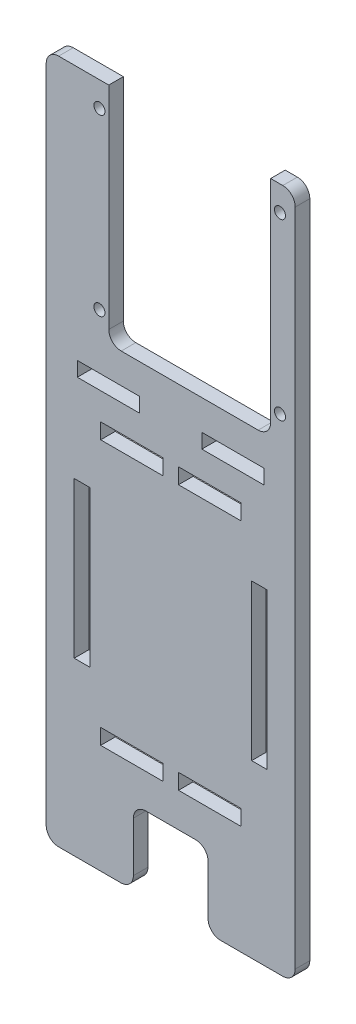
SolidWorks part; units mm, degrees
ref_plane "Front Plane" through (0, 0, 0) normal (0, 0, 1) x (1, 0, 0)
ref_plane "Top Plane" through (0, 0, 0) normal (0, 1, 0) x (1, 0, 0)
ref_plane "Right Plane" through (0, 0, 0) normal (1, 0, 0) x (0, 0, -1)
sketch "Sketch1" plane through (0, 0, 0) normal (0, 0, 1) x (1, 0, 0)
  line L1 (-25.4, -69.85) -> (25.4, -69.85)
  line L2 (-25.4, -69.85) -> (-25.4, 69.85)
  line L3 (-25.4, 69.85) -> (25.4, 69.85)
  line L4 (25.4, -69.85) -> (25.4, 69.85)
  line L5 (-25.4, -69.85) -> (25.4, 69.85) construction
  line L6 (-25.4, 69.85) -> (25.4, -69.85) construction
  point P0 (0, 0)
  dimension "D1" = 139.7
  dimension "D2" = 50.8
extrude "Boss-Extrude1" add sketch "Sketch1" along normal blind 2.9718
sketch "Sketch3" plane through (0, 0, 2.9718) normal (0, 0, 1) x (1, 0, 0)
  line L0 (0, -69.85) -> (0, 0.6319) construction
  line L1 (-25.4, -69.85) -> (25.4, -69.85) construction
  line L3 (-7.62, -54.61) -> (7.62, -54.61)
  line L4 (-7.62, -54.61) -> (-7.62, -92.71)
  line L5 (-7.62, -92.71) -> (7.62, -92.71)
  line L6 (7.62, -54.61) -> (7.62, -92.71)
  line L7 (-7.62, -54.61) -> (7.62, -92.71) construction
  line L8 (-7.62, -92.71) -> (7.62, -54.61) construction
  point P5 (0, -73.66)
  dimension "D1" = 38.1
  dimension "D2" = 15.24
  dimension "D3" = 22.86
extrude "Cut-Extrude2" cut sketch "Sketch3" against normal through all
sketch "Sketch22" plane through (0, 0, 2.9718) normal (0, 0, 1) x (1, 0, 0)
  line L0 (25.4, 69.85) -> (-25.4, 69.85) construction
  line L1 (-12.6375, 69.85) -> (20.3825, 69.85)
  line L2 (-12.6375, 69.85) -> (-12.6375, 24.13)
  line L3 (-12.6375, 24.13) -> (20.3825, 24.13)
  line L4 (20.3825, 69.85) -> (20.3825, 24.13)
  line L5 (-12.6375, 69.85) -> (20.3825, 24.13) construction
  line L6 (-12.6375, 24.13) -> (20.3825, 69.85) construction
  line L7 (0, 0) -> (0, 122.4243) construction
  point P0 (3.8725, 46.99)
  dimension "D1" = 33.02
  dimension "D2" = 45.72
  dimension "D3" = 22.86
  dimension "D4" = 3.8725
extrude "Cut-Extrude8" cut sketch "Sketch22" against normal through all
hole_wizard "#2 Clearance Hole1" positions "Sketch24" profile "Sketch25" hole size "#2" standard "ANSI Inch"
sketch "Sketch24" plane through (0, 0, 2.9718) normal (0, 0, 1) x (1, 0, 0)
  line L0 (22.2875, 69.85) -> (22.2875, 79.055) construction
  line L1 (25.4, 69.85) -> (20.3825, 69.85) construction
  line L3 (-14.5425, 69.85) -> (-14.5425, 79.5197) construction
  line L4 (-12.6375, 69.85) -> (-25.4, 69.85) construction
  line L6 (-25.4, 64.77) -> (25.4, 64.77) construction
  line L7 (-25.4, 69.85) -> (-25.4, -69.85) construction
  line L8 (25.4, -69.85) -> (25.4, 69.85) construction
  line L10 (-25.4, 29.21) -> (25.4, 29.21) construction
  line L12 (20.3825, 24.13) -> (20.3825, 69.85) construction
  line L14 (-12.6375, 69.85) -> (-12.6375, 24.13) construction
  line L15 (-12.6375, 24.13) -> (20.3825, 24.13) construction
  point P32 (-14.5425, 64.77)
  point P34 (-14.5425, 29.21)
  point P36 (22.2875, 64.77)
  point P38 (22.2875, 29.21)
  dimension "D1" = 5.08
  dimension "D2" = 1.905
  dimension "D3" = 1.905
  dimension "D4" = 5.08
sketch "Sketch25" plane through (22.2875, 29.21, 2.9718) normal (1, 0, 0) x (0, -1, 0)
  line L0 (0, 0) -> (0, 2.9718)
  line L1 (0, 2.9718) -> (1.1303, 2.9718)
  line L2 (1.1303, 2.9718) -> (1.1303, 0)
  line L5 (1.1303, 0) -> (0, 0)
  line L11 (0, -6.35) -> (0, 107.95) construction
  dimension "Thru Hole Dia." = 2.2606
  dimension "Thru Hole Depth" = 2.9718
fillet "Fillet1" radius 2.54 10 edges at (20.3825, 24.13, 1.4859) (-12.6375, 24.13, 1.4859) (-25.4, 69.85, 1.4859) (25.4, 69.85, 1.4859) (-25.4, -69.85, 1.4859) (25.4, -69.85, 1.4859) (-7.62, -54.61, 1.4859) (-7.62, -69.85, 1.4859) (7.62, -69.85, 1.4859) (7.62, -54.61, 1.4859)
sketch "Sketch26" plane through (0, 0, 2.9718) normal (0, 0, 1) x (1, 0, 0)
  line L0 (0, 0) -> (0, -75.1956) construction
  line L1 (0, 0) -> (23.1244, 0) construction
  line L2 (-20.2138, -19.05) -> (21.3275, -19.05) construction
  line L3 (7.9375, -18.5177) -> (7.9375, -58.8203) construction
  line L4 (16.51, -3.175) -> (19.685, -3.175)
  line L5 (16.51, -3.175) -> (16.51, -34.925)
  line L6 (16.51, -34.925) -> (19.685, -34.925)
  line L7 (19.685, -3.175) -> (19.685, -34.925)
  line L8 (16.51, -3.175) -> (19.685, -34.925) construction
  line L9 (16.51, -34.925) -> (19.685, -3.175) construction
  line L10 (-16.51, -34.925) -> (-19.685, -3.175) construction
  line L11 (1.5875, -44.45) -> (14.2875, -44.45)
  line L12 (1.5875, -44.45) -> (1.5875, -47.625)
  line L13 (1.5875, -47.625) -> (14.2875, -47.625)
  line L14 (14.2875, -44.45) -> (14.2875, -47.625)
  line L15 (1.5875, -44.45) -> (14.2875, -47.625) construction
  line L16 (1.5875, -47.625) -> (14.2875, -44.45) construction
  line L17 (-16.51, -3.175) -> (-19.685, -34.925) construction
  line L18 (-19.685, -3.175) -> (-19.685, -34.925)
  line L19 (-16.51, -34.925) -> (-19.685, -34.925)
  line L20 (-16.51, -3.175) -> (-16.51, -34.925)
  line L21 (-16.51, -3.175) -> (-19.685, -3.175)
  line L22 (-1.5875, -47.625) -> (-14.2875, -44.45) construction
  line L23 (-1.5875, -44.45) -> (-14.2875, -47.625) construction
  line L24 (-7.9375, -18.5177) -> (-7.9375, -58.8203) construction
  line L25 (-14.2875, -44.45) -> (-14.2875, -47.625)
  line L26 (-1.5875, -47.625) -> (-14.2875, -47.625)
  line L27 (-1.5875, -44.45) -> (-1.5875, -47.625)
  line L28 (-1.5875, -44.45) -> (-14.2875, -44.45)
  line L29 (-1.5875, 6.35) -> (-14.2875, 9.525) construction
  line L30 (-1.5875, 9.525) -> (-14.2875, 6.35) construction
  line L31 (1.5875, 9.525) -> (14.2875, 6.35) construction
  line L32 (1.5875, 6.35) -> (14.2875, 9.525) construction
  line L33 (-1.5875, 6.35) -> (-14.2875, 6.35)
  line L34 (-1.5875, 6.35) -> (-1.5875, 9.525)
  line L35 (-1.5875, 9.525) -> (-14.2875, 9.525)
  line L36 (-14.2875, 6.35) -> (-14.2875, 9.525)
  line L37 (14.2875, 6.35) -> (14.2875, 9.525)
  line L38 (1.5875, 9.525) -> (14.2875, 9.525)
  line L39 (1.5875, 6.35) -> (1.5875, 9.525)
  line L40 (1.5875, 6.35) -> (14.2875, 6.35)
  point P7 (18.0975, -19.05)
  point P13 (7.9375, -46.0375)
  point P22 (-18.0975, -19.05)
  point P29 (-7.9375, -46.0375)
  point P38 (-7.9375, 7.9375)
  point P39 (7.9375, 7.9375)
extrude "Cut-Extrude9" cut sketch "Sketch26" against normal through all
sketch "Sketch27" plane through (0, 0, 2.9718) normal (0, 0, 1) x (1, 0, 0)
  line L0 (0, 0) -> (0, 39.0224) construction
  line L1 (-31.7319, 16.51) -> (33.2642, 16.51) construction
  line L2 (-6.35, 15.0241) -> (-19.05, 17.9959) construction
  line L3 (6.35, 17.9959) -> (19.05, 17.9959)
  line L4 (6.35, 17.9959) -> (6.35, 15.0241)
  line L5 (6.35, 15.0241) -> (19.05, 15.0241)
  line L6 (19.05, 17.9959) -> (19.05, 15.0241)
  line L7 (6.35, 17.9959) -> (19.05, 15.0241) construction
  line L8 (6.35, 15.0241) -> (19.05, 17.9959) construction
  line L9 (-6.35, 17.9959) -> (-19.05, 15.0241) construction
  line L10 (31.7319, 16.51) -> (-33.2642, 16.51) construction
  line L11 (-19.05, 17.9959) -> (-19.05, 15.0241)
  line L12 (-6.35, 15.0241) -> (-19.05, 15.0241)
  line L13 (-6.35, 17.9959) -> (-6.35, 15.0241)
  line L14 (-6.35, 17.9959) -> (-19.05, 17.9959)
  line L15 (-10.0975, 24.13) -> (17.8425, 24.13) construction
  point P5 (12.7, 16.51)
  point P16 (-12.7, 16.51)
extrude "Cut-Extrude10" cut sketch "Sketch27" against normal through all
sketch "Sketch28" plane through (0, 0, 2.9718) normal (0, 0, 1) x (1, 0, 0)
  line L32 (-18.9484, 15.1257) -> (-6.4516, 15.1257)
  line L33 (-6.4516, 15.1257) -> (-6.4516, 17.8943)
  line L34 (-18.9484, 17.8943) -> (-18.9484, 15.1257)
  line L35 (-6.4516, 17.8943) -> (-18.9484, 17.8943)
  line L36 (-12.5359, 69.9516) -> (-22.86, 69.9516)
  line L37 (-25.5016, 67.31) -> (-25.5016, -67.31)
  line L38 (-22.86, -69.9516) -> (-10.16, -69.9516)
  line L39 (-7.5184, -67.31) -> (-7.5184, -57.15)
  line L40 (-5.08, -54.7116) -> (5.08, -54.7116)
  line L41 (7.5184, -57.15) -> (7.5184, -67.31)
  line L42 (10.16, -69.9516) -> (22.86, -69.9516)
  line L43 (25.5016, -67.31) -> (25.5016, 67.31)
  line L44 (22.86, 69.9516) -> (20.2809, 69.9516)
  line L45 (20.2809, 69.9516) -> (20.2809, 26.67)
  line L46 (17.8425, 24.2316) -> (-10.0975, 24.2316)
  line L47 (-12.5359, 26.67) -> (-12.5359, 69.9516)
  line L48 (-12.5359, 69.9516) -> (-22.86, 69.9516)
  line L49 (-25.5016, 67.31) -> (-25.5016, -67.31)
  line L50 (-22.86, -69.9516) -> (-10.16, -69.9516)
  line L51 (-7.5184, -67.31) -> (-7.5184, -57.15)
  line L52 (-5.08, -54.7116) -> (5.08, -54.7116)
  line L53 (7.5184, -57.15) -> (7.5184, -67.31)
  line L54 (10.16, -69.9516) -> (22.86, -69.9516)
  line L55 (25.5016, -67.31) -> (25.5016, 67.31)
  line L56 (22.86, 69.9516) -> (20.2809, 69.9516)
  line L57 (20.2809, 69.9516) -> (20.2809, 26.67)
  line L58 (17.8425, 24.2316) -> (-10.0975, 24.2316)
  line L59 (-12.5359, 26.67) -> (-12.5359, 69.9516)
  line L60 (-18.9484, 15.1257) -> (-6.4516, 15.1257)
  line L61 (-6.4516, 15.1257) -> (-6.4516, 17.8943)
  line L62 (-18.9484, 17.8943) -> (-18.9484, 15.1257)
  line L63 (-6.4516, 17.8943) -> (-18.9484, 17.8943)
  line L68 (18.9484, 15.1257) -> (18.9484, 17.8943)
  line L69 (18.9484, 17.8943) -> (6.4516, 17.8943)
  line L70 (6.4516, 17.8943) -> (6.4516, 15.1257)
  line L71 (6.4516, 15.1257) -> (18.9484, 15.1257)
  line L72 (18.9484, 15.1257) -> (18.9484, 17.8943)
  line L73 (18.9484, 17.8943) -> (6.4516, 17.8943)
  line L74 (6.4516, 17.8943) -> (6.4516, 15.1257)
  line L75 (6.4516, 15.1257) -> (18.9484, 15.1257)
  line L80 (-1.6891, 6.4516) -> (-1.6891, 9.4234)
  line L81 (-1.6891, 9.4234) -> (-14.1859, 9.4234)
  line L82 (-14.1859, 9.4234) -> (-14.1859, 6.4516)
  line L83 (-14.1859, 6.4516) -> (-1.6891, 6.4516)
  line L84 (-1.6891, 6.4516) -> (-1.6891, 9.4234)
  line L85 (-1.6891, 9.4234) -> (-14.1859, 9.4234)
  line L86 (-14.1859, 9.4234) -> (-14.1859, 6.4516)
  line L87 (-14.1859, 6.4516) -> (-1.6891, 6.4516)
  line L92 (1.6891, 9.4234) -> (1.6891, 6.4516)
  line L93 (14.1859, 9.4234) -> (1.6891, 9.4234)
  line L94 (14.1859, 6.4516) -> (14.1859, 9.4234)
  line L95 (1.6891, 6.4516) -> (14.1859, 6.4516)
  line L96 (1.6891, 9.4234) -> (1.6891, 6.4516)
  line L97 (14.1859, 9.4234) -> (1.6891, 9.4234)
  line L98 (14.1859, 6.4516) -> (14.1859, 9.4234)
  line L99 (1.6891, 6.4516) -> (14.1859, 6.4516)
  line L104 (-16.6116, -3.2766) -> (-19.5834, -3.2766)
  line L105 (-19.5834, -34.8234) -> (-16.6116, -34.8234)
  line L106 (-16.6116, -34.8234) -> (-16.6116, -3.2766)
  line L107 (-19.5834, -3.2766) -> (-19.5834, -34.8234)
  line L108 (-16.6116, -3.2766) -> (-19.5834, -3.2766)
  line L109 (-19.5834, -34.8234) -> (-16.6116, -34.8234)
  line L110 (-16.6116, -34.8234) -> (-16.6116, -3.2766)
  line L111 (-19.5834, -3.2766) -> (-19.5834, -34.8234)
  line L116 (16.6116, -34.8234) -> (19.5834, -34.8234)
  line L117 (19.5834, -3.2766) -> (16.6116, -3.2766)
  line L118 (19.5834, -34.8234) -> (19.5834, -3.2766)
  line L119 (16.6116, -3.2766) -> (16.6116, -34.8234)
  line L120 (16.6116, -34.8234) -> (19.5834, -34.8234)
  line L121 (19.5834, -3.2766) -> (16.6116, -3.2766)
  line L122 (19.5834, -34.8234) -> (19.5834, -3.2766)
  line L123 (16.6116, -3.2766) -> (16.6116, -34.8234)
  line L128 (-14.1859, -47.5234) -> (-1.6891, -47.5234)
  line L129 (-1.6891, -47.5234) -> (-1.6891, -44.5516)
  line L130 (-14.1859, -44.5516) -> (-14.1859, -47.5234)
  line L131 (-1.6891, -44.5516) -> (-14.1859, -44.5516)
  line L132 (-14.1859, -47.5234) -> (-1.6891, -47.5234)
  line L133 (-1.6891, -47.5234) -> (-1.6891, -44.5516)
  line L134 (-14.1859, -44.5516) -> (-14.1859, -47.5234)
  line L135 (-1.6891, -44.5516) -> (-14.1859, -44.5516)
  line L140 (1.6891, -44.5516) -> (1.6891, -47.5234)
  line L141 (14.1859, -44.5516) -> (1.6891, -44.5516)
  line L142 (14.1859, -47.5234) -> (14.1859, -44.5516)
  line L143 (1.6891, -47.5234) -> (14.1859, -47.5234)
  line L144 (1.6891, -44.5516) -> (1.6891, -47.5234)
  line L145 (14.1859, -44.5516) -> (1.6891, -44.5516)
  line L146 (14.1859, -47.5234) -> (14.1859, -44.5516)
  line L147 (1.6891, -47.5234) -> (14.1859, -47.5234)
  circle A22 centre (-14.5425, 64.77) radius 1.0287
  circle A23 centre (-14.5425, 64.77) radius 1.0287
  circle A25 centre (22.2875, 64.77) radius 1.0287
  circle A26 centre (22.2875, 64.77) radius 1.0287
  circle A28 centre (-14.5425, 29.21) radius 1.0287
  circle A29 centre (-14.5425, 29.21) radius 1.0287
  arc A30 (-22.86, 69.9516) -> (-25.5016, 67.31) centre (-22.86, 67.31) ccw
  arc A31 (-25.5016, -67.31) -> (-22.86, -69.9516) centre (-22.86, -67.31) ccw
  arc A32 (-10.16, -69.9516) -> (-7.5184, -67.31) centre (-10.16, -67.31) ccw
  arc A33 (-5.08, -54.7116) -> (-7.5184, -57.15) centre (-5.08, -57.15) ccw
  arc A34 (7.5184, -57.15) -> (5.08, -54.7116) centre (5.08, -57.15) ccw
  arc A35 (7.5184, -67.31) -> (10.16, -69.9516) centre (10.16, -67.31) ccw
  arc A36 (22.86, -69.9516) -> (25.5016, -67.31) centre (22.86, -67.31) ccw
  arc A37 (25.5016, 67.31) -> (22.86, 69.9516) centre (22.86, 67.31) ccw
  arc A38 (17.8425, 24.2316) -> (20.2809, 26.67) centre (17.8425, 26.67) ccw
  arc A39 (-12.5359, 26.67) -> (-10.0975, 24.2316) centre (-10.0975, 26.67) ccw
  arc A40 (-22.86, 69.9516) -> (-25.5016, 67.31) centre (-22.86, 67.31) ccw
  arc A41 (-25.5016, -67.31) -> (-22.86, -69.9516) centre (-22.86, -67.31) ccw
  arc A42 (-10.16, -69.9516) -> (-7.5184, -67.31) centre (-10.16, -67.31) ccw
  arc A43 (-5.08, -54.7116) -> (-7.5184, -57.15) centre (-5.08, -57.15) ccw
  arc A44 (7.5184, -57.15) -> (5.08, -54.7116) centre (5.08, -57.15) ccw
  arc A45 (7.5184, -67.31) -> (10.16, -69.9516) centre (10.16, -67.31) ccw
  arc A46 (22.86, -69.9516) -> (25.5016, -67.31) centre (22.86, -67.31) ccw
  arc A47 (25.5016, 67.31) -> (22.86, 69.9516) centre (22.86, 67.31) ccw
  arc A48 (17.8425, 24.2316) -> (20.2809, 26.67) centre (17.8425, 26.67) ccw
  arc A49 (-12.5359, 26.67) -> (-10.0975, 24.2316) centre (-10.0975, 26.67) ccw
  circle A51 centre (22.2875, 29.21) radius 1.0287
  circle A52 centre (22.2875, 29.21) radius 1.0287
equation "\"D5@Sketch26\"=1/16+1.3/2"
equation "\"D6@Sketch26\"=1/16+1"
equation "\"D7@Sketch26\"=1/16+.25"
equation "\"t\" = .117in'plywood thickness"
equation "\"kerf\"= .004in'laser cutter kerf"
equation "\"D1@Boss-Extrude1\"=\"t\""
equation "\"D1@Sketch28\"=\"kerf\""
equation "\"D2@Sketch28\"=\"kerf\""
equation "\"D3@Sketch28\"=\"kerf\""
equation "\"D4@Sketch28\"=\"kerf\""
equation "\"D5@Sketch28\"=\"kerf\""
equation "\"D6@Sketch28\"=\"kerf\""
equation "\"D7@Sketch28\"=\"kerf\""
equation "\"D9@Sketch28\"=\"kerf\""
equation "\"D8@Sketch28\"=\"kerf\""
equation "\"D10@Sketch28\"=\"kerf\""
equation "\"D11@Sketch28\"=\"kerf\""
equation "\"D12@Sketch28\"=\"kerf\""
equation "\"D13@Sketch28\"=\"kerf\""
equation "\"D4@Sketch27\"=\"t\""
